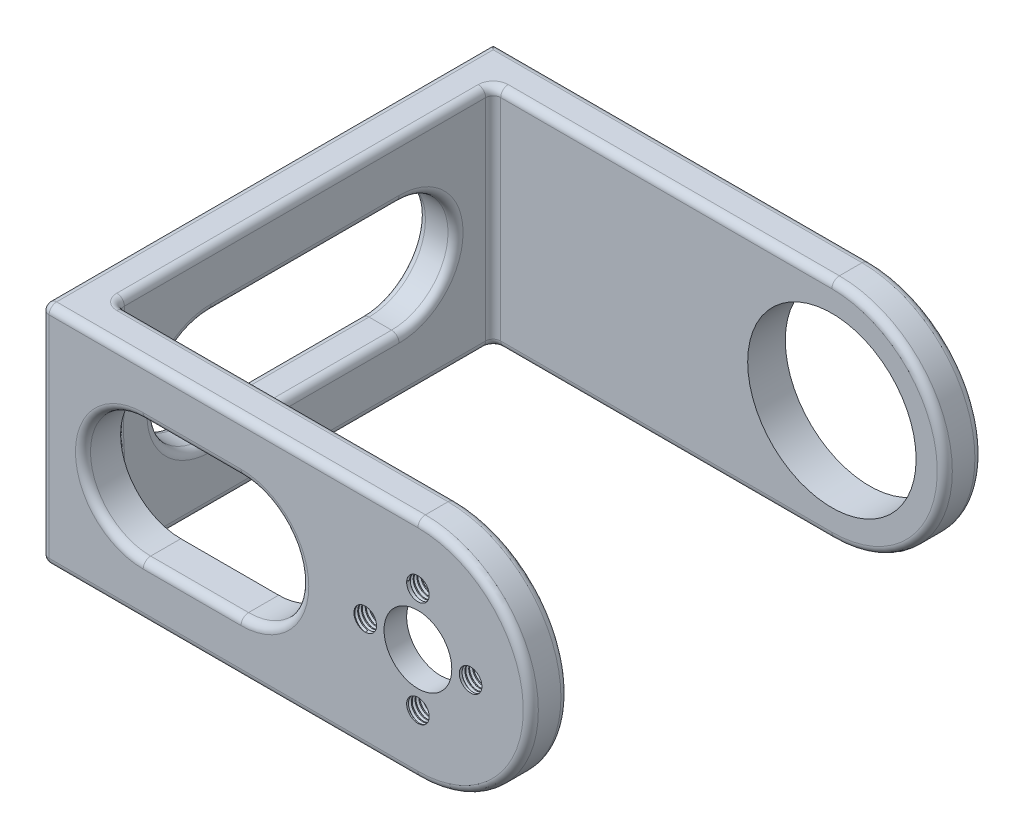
SolidWorks part; units mm, degrees
ref_plane "Front Plane" through (0, 0, 0) normal (0, 0, 1) x (1, 0, 0)
ref_plane "Top Plane" through (0, 0, 0) normal (0, 1, 0) x (1, 0, 0)
ref_plane "Right Plane" through (0, 0, 0) normal (1, 0, 0) x (0, 0, -1)
sketch "Sketch1" plane through (0, 0, 0) normal (0, 0, 1) x (1, 0, 0)
  line L3 (0, 15) -> (-50, 15)
  line L4 (-50, 15) -> (-50, -15)
  line L5 (-50, -15) -> (0, -15)
  line L6 (0, 15) -> (0, -15) construction
  line L7 (15, 0) -> (-50, 0) construction
  arc A2 (0, -15) -> (0, 15) centre (0, 0) ccw
  circle A3 centre (0, 0) radius 4.5
  circle A4 centre (0, 7) radius 1.5
  circle A5 centre (7, 0) radius 1.5
  circle A6 centre (0, -7) radius 1.5
  circle A7 centre (-7, 0) radius 1.5
  point P20 (0, 0)
  dimension "D1" = 30
  dimension "D5" = 14
  dimension "D3" = 9
  dimension "D4" = 3
  dimension "D2" = 50
  dimension "D6" = 4
extrude "Boss-Extrude1" add sketch "Sketch1" along normal blind 5
sketch "Sketch2" plane through (0, 0, 0) normal (0, 0, -1) x (-1, 0, 0)
  line L0 (50, -15) -> (0, -15) construction
  line L1 (50, 15) -> (45, 15)
  line L2 (50, 15) -> (50, -15)
  line L3 (50, -15) -> (45, -15)
  line L4 (45, 15) -> (45, -15)
  dimension "D1" = 5
extrude "Boss-Extrude2" add sketch "Sketch2" along normal blind 55
ref_plane "Plane1" through (0, 0, -25) normal (0, 0, -1) x (-1, 0, 0)
mirror "Mirror1" about plane through (0, 0, -25) normal (0, 0, -1) of "Boss-Extrude1"
sketch "Sketch4" plane through (0, 0, 0) normal (0, 0, -1) x (-1, 0, 0)
  circle A0 centre (0, 0) radius 10.19
  dimension "D1" = 20.38
extrude "Cut-Extrude1" cut sketch "Sketch4" against normal blind 2
sketch "Sketch5" plane through (0, 0, 5) normal (0, 0, 1) x (1, 0, 0)
  line L0 (-36.5, 0) -> (-23.5, 0) construction
  line L1 (-36.5, 8) -> (-23.5, 8)
  line L2 (-36.5, -8) -> (-23.5, -8)
  line L3 (0, 15) -> (-50, 15) construction
  line L5 (-50, 15) -> (-50, -15) construction
  arc A0 (-36.5, 8) -> (-36.5, -8) centre (-36.5, 0) ccw
  arc A1 (-23.5, -8) -> (-23.5, 8) centre (-23.5, 0) ccw
  point P3 (-30, 0)
  dimension "D3" = 20
  dimension "D1" = 13
  dimension "D2" = 7
extrude "Cut-Extrude2" cut sketch "Sketch5" against normal up to next
sketch "Sketch7" plane through (-45, 0, 0) normal (1, 0, 0) x (0, 0, -1)
  line L0 (12.5, 0) -> (37.5, 0) construction
  line L1 (12.5, 7.5) -> (37.5, 7.5)
  line L2 (12.5, -7.5) -> (37.5, -7.5)
  line L3 (50, 15) -> (0, 15) construction
  arc A0 (12.5, 7.5) -> (12.5, -7.5) centre (12.5, 0) ccw
  arc A1 (37.5, -7.5) -> (37.5, 7.5) centre (37.5, 0) ccw
  point P3 (25, 0)
  point P10 (25, 15)
  dimension "D1" = 25
  dimension "D2" = 15
extrude "Cut-Extrude3" cut sketch "Sketch7" against normal through all
fillet "Fillet1" radius 1 31 edges at (-44.5, 0, 5) (-30, -8, 5) (-15.5, 0, 5) (-30, 8, 5) (-50, 0, -5) (-50, 7.5, -25) (-50, 0, -45) (-50, -7.5, -25) (-45, 0, -5) (-45, -7.5, -25) (-45, 0, -45) (-45, 7.5, -25) (-50, 0, 5) (-25, -15, 5) (-22.5, -15, 0) (-45, 0, 0) (-25, 15, -55) (-25, -15, -55) (-45, -15, -25) (-45, 15, -25) (-45, 0, -50) (15, 0, 5) (-22.5, 15, -50) (-22.5, -15, -50) (15, 0, -50) (15, 0, -55) (-22.5, 15, 0) (15, 0, 0) (-50, -15, -25) (-50, 15, -25) (-25, 15, 5)
thread "Thread1" pitch 0.5 start angle 0, offset 0, length 0, pitch 0.5, diameter 3
ref_plane "Plane2" through (-1.5, 7, 5) normal (0, -1, 0) x (-1, 0, 0)
sketch "Thread Profile1" plane through (-1.5, 7, 5) normal (0, -1, 0) x (-1, 0, 0)
  line L0 (0, 0) -> (0, 0.5) construction
  line L1 (0, 0) -> (0.2706, 0.1562)
  line L2 (0.2706, 0.1562) -> (0.2706, 0.2187)
  line L3 (0.2706, 0.2187) -> (0, 0.375)
  line L4 (0.2706, 0.1875) -> (0, 0.1875) construction
  line L11 (0, 0) -> (0, 0.375)
  point P2 (0, 0)
  dimension "Pitch" = 0.5
  dimension "Profile_Angle" = 60
  dimension "Profile_Land" = 0.0625
  dimension "Profile_Height" = 0.2706
pattern_circular "CirPattern1" count 4 over 360 about axis through (0, 0, 5) along (0, 0, 1) of "Thread1"
thread "Thread2" pitch 0.5 start angle 0, offset 0, length 0, pitch 0.5, diameter 3
ref_plane "Plane3" through (1.5, 7, -55) normal (0, -1, 0) x (1, 0, 0)
sketch "Thread Profile2" plane through (1.5, 7, -55) normal (0, -1, 0) x (1, 0, 0)
  line L0 (0, 0) -> (0, 0.5) construction
  line L1 (0, 0) -> (0.2706, 0.1562)
  line L2 (0.2706, 0.1562) -> (0.2706, 0.2187)
  line L3 (0.2706, 0.2187) -> (0, 0.375)
  line L4 (0.2706, 0.1875) -> (0, 0.1875) construction
  line L11 (0, 0) -> (0, 0.375)
  point P2 (0, 0)
  dimension "Pitch" = 0.5
  dimension "Profile_Angle" = 60
  dimension "Profile_Land" = 0.0625
  dimension "Profile_Height" = 0.2706
pattern_circular "CirPattern2" count 4 over 360 of "Thread2"
sketch "Sketch8" plane through (0, 0, -55) normal (0, 0, -1) x (-1, 0, 0)
  circle A0 centre (0, 0) radius 11.19
  dimension "D1" = 22.38
extrude "Cut-Extrude5" cut sketch "Sketch8" against normal up to next
